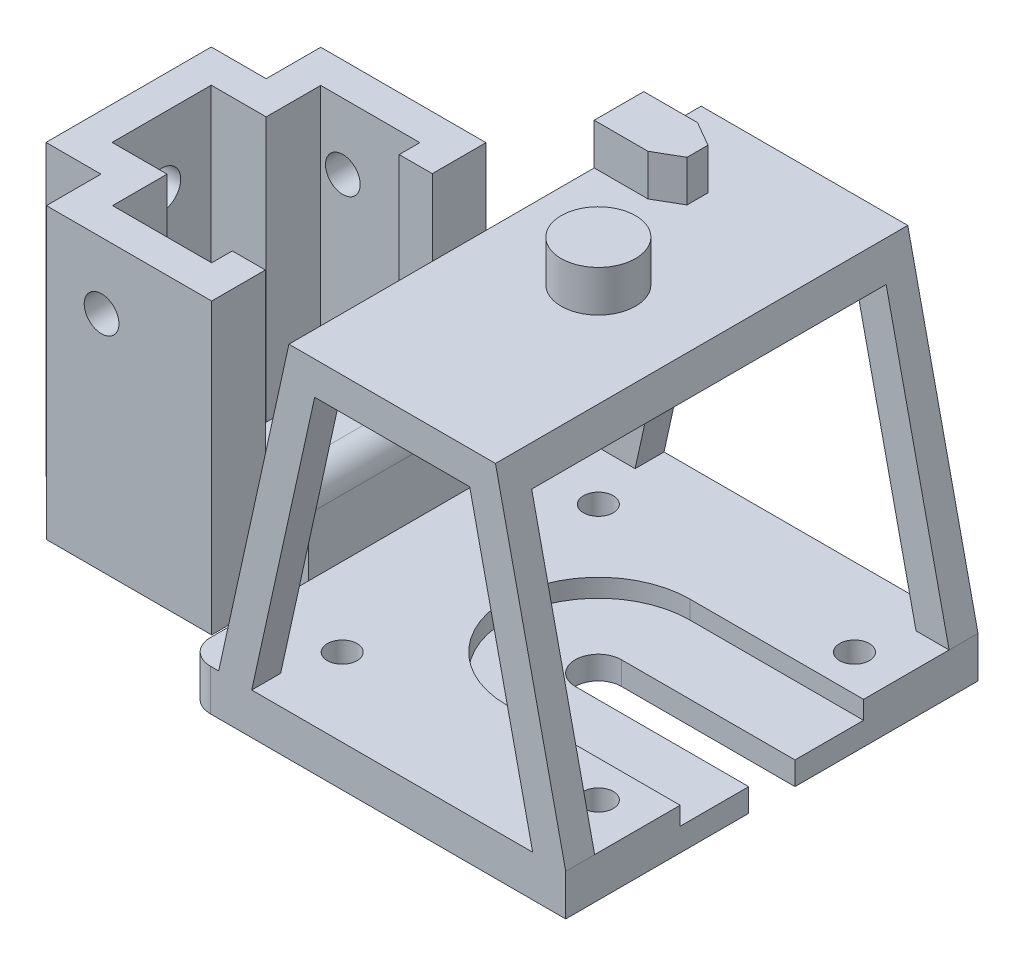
SolidWorks part; units mm, degrees
ref_plane "Front Plane" through (0, 0, 0) normal (0, 0, 1) x (1, 0, 0)
ref_plane "Top Plane" through (0, 0, 0) normal (0, 1, 0) x (1, 0, 0)
ref_plane "Right Plane" through (0, 0, 0) normal (1, 0, 0) x (0, 0, -1)
sketch "Sketch1" plane through (0, 0, 0) normal (0, 1, 0) x (1, 0, 0)
  line L0 (0, -10) -> (0, 10)
  line L1 (0, 10) -> (6.65, 10)
  line L2 (6.65, 10) -> (6.65, 16.6)
  line L3 (6.65, 16.6) -> (26.65, 16.6)
  line L4 (26.65, 16.6) -> (26.65, 10.1)
  line L5 (26.65, 10.1) -> (31.85, 10.1)
  line L6 (31.85, 10.1) -> (31.85, 24.95)
  line L11 (0, 0) -> (12.6321, 0) construction
  line L12 (77.85, -24.95) -> (56.85, -24.95)
  line L13 (77.85, -24.95) -> (77.85, 24.95)
  line L14 (77.85, 24.95) -> (56.85, 24.95)
  line L16 (77.85, -24.95) -> (35.85, 24.95) construction
  line L17 (77.85, 24.95) -> (35.85, -24.95) construction
  line L18 (26.65, -10.1) -> (31.85, -10.1)
  line L23 (31.85, -10.1) -> (31.85, -24.95)
  line L24 (26.65, -16.6) -> (26.65, -10.1)
  line L25 (6.65, -16.6) -> (26.65, -16.6)
  line L26 (6.65, -10) -> (6.65, -16.6)
  line L27 (0, -10) -> (6.65, -10)
  line L28 (56.85, -24.95) -> (35.85, -24.95) construction
  line L29 (35.85, -24.95) -> (35.85, 24.95) construction
  line L30 (35.85, 24.95) -> (56.85, 24.95) construction
  line L31 (-5, 10) -> (-5, -10) construction
  line L32 (31.85, 24.95) -> (56.85, 24.95)
  line L33 (31.85, -24.95) -> (56.85, -24.95)
  point P4 (0, 0)
  point P8 (56.85, 0)
  dimension "D1" = 20
  dimension "D2" = 6.65
  dimension "D3" = 6.6
  dimension "D4" = 20
  dimension "D5" = 6.5
  dimension "D6" = 5.2
  dimension "D8" = 49.9
  dimension "D9" = 42
  dimension "D11" = 4
  dimension "D13" = 5
extrude "Boss-Extrude1" add sketch "Sketch1" along normal blind 5 contours L3 L4 L5 L6 L32 L14 L13 L12 L33 L23 L18 L24 L25 L26 L27 L0 L1 L2
sketch "Sketch2" plane through (0, 5, 0) normal (0, 1, 0) x (1, 0, 0)
  line L0 (77.85, -24.95) -> (77.85, 24.95) construction
  line L1 (56.85, 2.8) -> (77.85, 2.8)
  line L2 (77.85, 2.8) -> (77.85, -2.8)
  line L3 (77.85, -2.8) -> (56.85, -2.8)
  line L5 (72.35, -15.5) -> (41.35, -15.5) construction
  line L6 (72.35, -15.5) -> (72.35, 15.5) construction
  line L7 (72.35, 15.5) -> (41.35, 15.5) construction
  line L8 (41.35, -15.5) -> (41.35, 15.5) construction
  line L9 (72.35, -15.5) -> (41.35, 15.5) construction
  line L10 (72.35, 15.5) -> (41.35, -15.5) construction
  arc A0 (56.85, 2.8) -> (56.85, -2.8) centre (56.85, 0) ccw
  circle A1 centre (41.35, 15.5) radius 1.8
  circle A2 centre (72.35, 15.5) radius 1.8
  circle A3 centre (72.35, -15.5) radius 1.8
  circle A4 centre (41.35, -15.5) radius 1.8
  dimension "D2" = 5.6
  dimension "D5" = 3.6
  dimension "D1" = 21
  dimension "D3" = 31
  dimension "D4" = 31
  dimension "D6" = 4
extrude "Cut-Extrude1" cut sketch "Sketch2" against normal blind 15
sketch "Sketch3" plane through (0, 5, 0) normal (0, 1, 0) x (1, 0, 0)
  line L0 (56.85, 11.1) -> (77.85, 11.1)
  line L1 (77.85, 2.8) -> (77.85, 24.95) construction
  line L2 (77.85, 11.1) -> (77.85, -11.1)
  line L3 (77.85, -24.95) -> (77.85, -2.8) construction
  line L4 (77.85, -11.1) -> (56.85, -11.1)
  arc A0 (56.85, 11.1) -> (56.85, -11.1) centre (56.85, 0) ccw
  dimension "D1" = 22.2
extrude "Cut-Extrude2" cut sketch "Sketch3" against normal blind 2.2
sketch "Sketch5" plane through (0, 0, 24.95) normal (0, 0, 1) x (1, 0, 0)
  line L0 (77.85, 5) -> (35.85, 5) construction
  line L2 (35.85, 5) -> (44.35, 43.5)
  line L3 (44.35, 43.5) -> (69.35, 43.5)
  line L4 (69.35, 43.5) -> (77.85, 5)
  line L5 (77.85, 5) -> (73.85, 5)
  line L6 (73.85, 5) -> (66.2331, 39.5)
  line L7 (66.2331, 39.5) -> (47.4669, 39.5)
  line L8 (47.4669, 39.5) -> (39.85, 5)
  line L9 (39.85, 5) -> (35.85, 5)
  dimension "D1" = 42
  dimension "D2" = 34.5
  dimension "D3" = 4
  dimension "D4" = 4
  dimension "D5" = 25
extrude "Boss-Extrude2" add sketch "Sketch5" against normal blind 3.5
mirror "Mirror1" about plane through (0, 0, 0) normal (0, 0, 1) of "Boss-Extrude2"
sketch "Sketch6" plane through (0, 0, 21.45) normal (0, 0, -1) x (-1, 0, 0)
  line L0 (-69.35, 43.5) -> (-44.35, 43.5)
  line L1 (-44.35, 43.5) -> (-43.4669, 39.5)
  line L2 (-44.35, 43.5) -> (-35.85, 5) construction
  line L3 (-43.4669, 39.5) -> (-70.2331, 39.5)
  line L4 (-77.85, 5) -> (-69.35, 43.5) construction
  line L5 (-70.2331, 39.5) -> (-69.35, 43.5)
  line L6 (-47.4669, 39.5) -> (-66.2331, 39.5) construction
extrude "Boss-Extrude3" add sketch "Sketch6" along normal up to next
sketch "Sketch7" plane through (0, 43.5, 0) normal (0, 1, 0) x (1, 0, 0)
  line L0 (69.35, 24.95) -> (44.35, 24.95) construction
  circle A0 centre (56.85, 0) radius 4.5
  point P2 (56.85, 24.95)
  dimension "D1" = 9
extrude "Boss-Extrude4" add sketch "Sketch7" along normal blind 5
sketch "Sketch10" plane through (0, 5, 0) normal (0, 1, 0) x (1, 0, 0)
  line L1 (6.65, -10) -> (6.65, -16.6) construction
  line L2 (0, -10) -> (6.65, -10) construction
  line L3 (0, -10) -> (0, 10) construction
  line L4 (0, 10) -> (6.65, 10) construction
  line L5 (6.65, 10) -> (6.65, 16.6) construction
  line L7 (6.65, -16.6) -> (26.65, -16.6) construction
  line L8 (6.65, -10) -> (6.65, -16.6)
  line L9 (0, -10) -> (6.65, -10)
  line L10 (0, -10) -> (0, 10)
  line L11 (0, 10) -> (6.65, 10)
  line L12 (6.65, 10) -> (6.65, 16.6)
  line L13 (26.65, -16.6) -> (26.65, -10.1) construction
  line L14 (26.65, 16.6) -> (26.65, 10.1) construction
  line L15 (6.65, 16.6) -> (26.65, 16.6) construction
  line L16 (6.65, -16.6) -> (26.65, -16.6)
  line L17 (26.65, -16.6) -> (26.65, -10.1)
  line L18 (26.65, 16.6) -> (26.65, 10.1)
  line L19 (6.65, 16.6) -> (26.65, 16.6)
  line L20 (22.65, -12.6) -> (22.65, -10.1)
  line L21 (10.65, -12.6) -> (22.65, -12.6)
  line L22 (10.65, -6) -> (10.65, -12.6)
  line L23 (4, -6) -> (10.65, -6)
  line L24 (4, -6) -> (4, 6)
  line L25 (4, 6) -> (10.65, 6)
  line L26 (10.65, 6) -> (10.65, 12.6)
  line L27 (10.65, 12.6) -> (22.65, 12.6)
  line L28 (22.65, 12.6) -> (22.65, 10.1)
  line L29 (22.65, 10.1) -> (26.65, 10.1)
  line L30 (22.65, -10.1) -> (26.65, -10.1)
  dimension "D1" = 4
extrude "Boss-Extrude6" add sketch "Sketch10" along normal blind 30
sketch "Sketch12" plane through (0, 5, 0) normal (0, 1, 0) x (1, 0, 0)
  line L0 (22.65, -10.1) -> (22.65, -12.6) construction
  line L1 (22.65, -12.6) -> (10.65, -12.6) construction
  line L2 (10.65, -12.6) -> (10.65, -6) construction
  line L3 (10.65, -6) -> (4, -6) construction
  line L4 (4, -6) -> (4, 6) construction
  line L5 (4, 6) -> (10.65, 6) construction
  line L6 (10.65, 6) -> (10.65, 12.6) construction
  line L7 (10.65, 12.6) -> (22.65, 12.6) construction
  line L8 (22.65, 12.6) -> (22.65, 10.1) construction
  line L9 (22.65, -10.1) -> (22.65, -12.6)
  line L10 (22.65, -12.6) -> (10.65, -12.6)
  line L11 (10.65, -12.6) -> (10.65, -6)
  line L12 (10.65, -6) -> (4, -6)
  line L13 (4, -6) -> (4, 6)
  line L14 (4, 6) -> (10.65, 6)
  line L15 (10.65, 6) -> (10.65, 12.6)
  line L16 (10.65, 12.6) -> (22.65, 12.6)
  line L17 (22.65, 12.6) -> (22.65, 10.1)
  line L18 (22.65, 10.1) -> (22.65, -10.1)
extrude "Cut-Extrude4" cut sketch "Sketch12" against normal blind 49
sketch "Sketch13" plane through (0, 43.5, 0) normal (0, 1, 0) x (1, 0, 0)
  line L0 (53.85, 16.2679) -> (50.85, 18)
  line L1 (44.35, 18) -> (50.85, 18)
  line L2 (44.35, 18) -> (44.35, 12)
  line L3 (44.35, 12) -> (50.85, 12)
  line L5 (53.85, 13.7321) -> (50.85, 12)
  line L6 (44.35, 24.95) -> (44.35, -24.95) construction
  line L7 (53.85, 16.2679) -> (53.85, 13.7321)
  circle A0 centre (56.85, 0) radius 4.5 construction
  circle A1 centre (56.85, 0) radius 4.5 construction
  point P3 (53.85, 15)
  dimension "D1" = 3
  dimension "D2" = 6
  dimension "D3" = 30
  dimension "D4" = 3
  dimension "D5" = 15
extrude "Boss-Extrude7" add sketch "Sketch13" along normal blind 5
fillet "Fillet3" radius 3 2 edges at (31.85, 2.5, 24.95) (31.85, 2.5, -24.95)
sketch "Sketch14" plane through (0, 0, 16.6) normal (0, 0, 1) x (1, 0, 0)
  line L0 (0, 35) -> (26.65, 35) construction
  circle A0 centre (13.325, 27) radius 2.1
  point P4 (13.325, 35)
  dimension "D1" = 4.2
  dimension "D2" = 8
extrude "Cut-Extrude5" cut sketch "Sketch14" against normal blind 46
sketch "Sketch15" plane through (0, 0, 0) normal (-1, 0, 0) x (0, 0, 1)
  line L0 (-10, 35) -> (10, 35) construction
  circle A0 centre (0, 27) radius 2.3
  dimension "D1" = 4.6
  dimension "D2" = 8
extrude "Cut-Extrude6" cut sketch "Sketch15" against normal blind 13
sketch "Sketch16" plane through (0, 5, 0) normal (0, 1, 0) x (1, 0, 0)
  line L1 (22.65, 10.1) -> (31.85, 10.1)
  line L2 (22.65, 10.1) -> (22.65, -10.1)
  line L3 (22.65, -10.1) -> (31.85, -10.1)
  line L4 (31.85, 10.1) -> (31.85, -10.1)
extrude "Boss-Extrude8" add sketch "Sketch16" along normal blind 10
fillet "Fillet4" radius 3 1 edges at (31.85, 15, 0)
